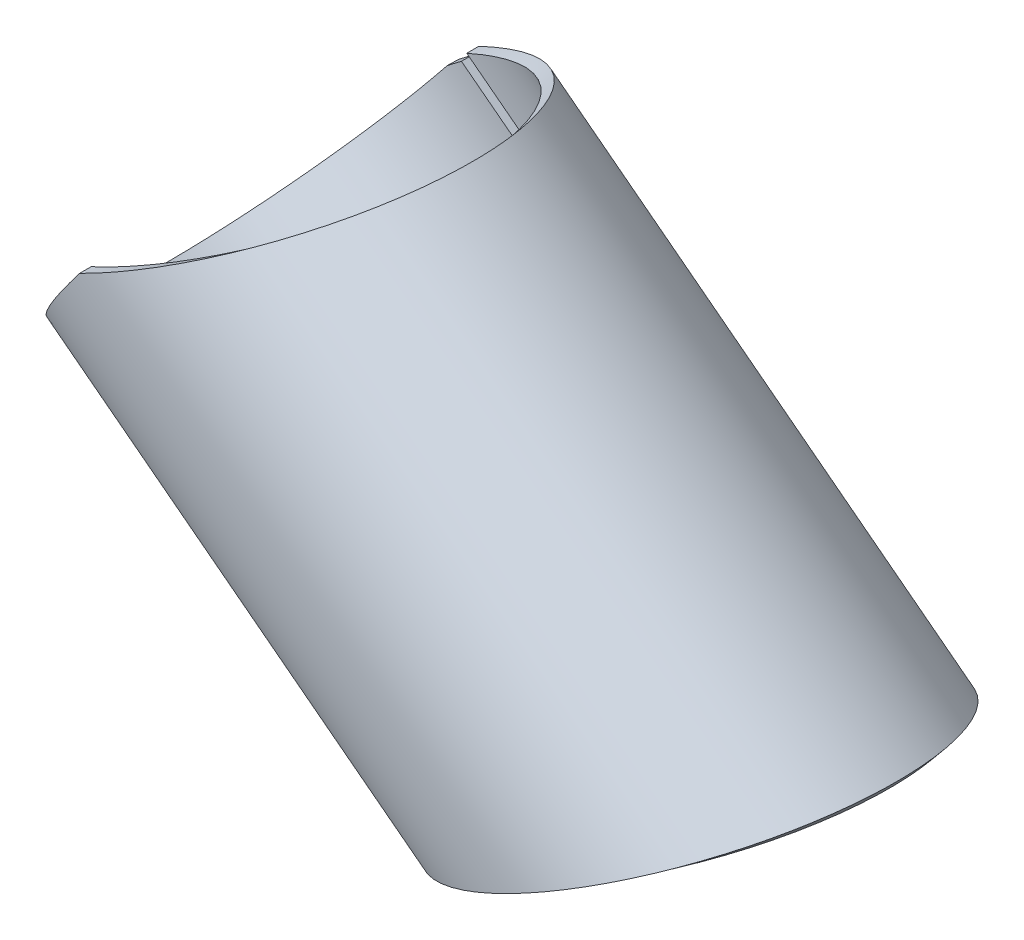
SolidWorks part; units mm, degrees
ref_plane "前视基准面" through (0, 0, 0) normal (0, 0, 1) x (1, 0, 0)
ref_plane "上视基准面" through (0, 0, 0) normal (0, 1, 0) x (1, 0, 0)
ref_plane "右视基准面" through (0, 0, 0) normal (1, 0, 0) x (0, 0, -1)
imported_body "基体零件-长短脚任意角度裤形三通管-1"
sheet metal parameters "钣金1" parameters "D1"=0.7366, "厚度"=1
bend "圆角折弯1" bend radius 15.9772 bend angle 356.625 parameters "D5"=1
flatten bends "展开-折弯1"
sketch "尖角-草图1" plane through (18.7935, -13.7946, -16.9698) normal (0.0179, 0.0234, -0.9996) x (-0.9998, 0.0004, -0.0179)
  line L0 (-48.3676, 25.5629) -> (-12.0247, 53.4457) construction
  dimension "D1" = 0
process bends "加工-折弯1" parameters "D1"=0
sketch "平面-草图1" plane through (18.7935, -13.7946, -16.9698) normal (0.0179, 0.0234, -0.9996) x (-0.9998, 0.0004, -0.0179)
